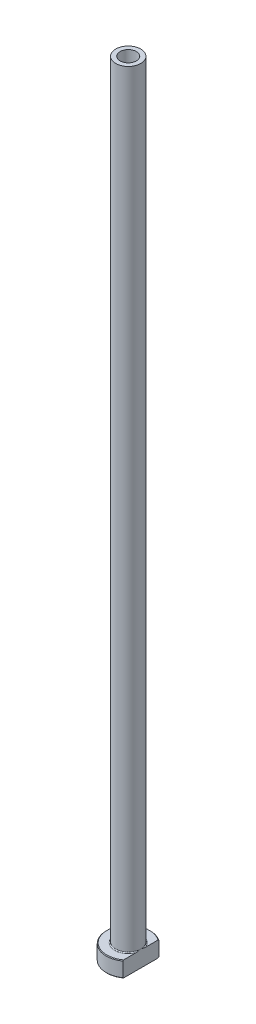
SolidWorks part; units mm, degrees
ref_plane "Front Plane" through (0, 0, 0) normal (0, 0, 1) x (1, 0, 0)
ref_plane "Top Plane" through (0, 0, 0) normal (0, 1, 0) x (1, 0, 0)
ref_plane "Right Plane" through (0, 0, 0) normal (1, 0, 0) x (0, 0, -1)
sketch "Sketch1" plane through (0, 0, 0) normal (0, 0, 1) x (1, 0, 0)
  line L0 (-2.6, 250) -> (-4, 250)
  line L1 (-4, 250) -> (-4, 5)
  line L2 (-4, 5) -> (-7, 5)
  line L3 (-7, 5) -> (-7, 0)
  line L4 (6.05, 0) -> (-6.05, 0) construction
  line L5 (-7, 0) -> (-2.85, 0)
  line L6 (-2.6, 205) -> (-2.6, 250)
  line L7 (0, 92.1877) -> (0, -15.5353) construction
  line L8 (0, -7.7) -> (0, 7.7) construction
  line L9 (-2.6, 205) -> (-2.85, 193)
  line L10 (-2.85, 193) -> (-2.85, 0)
  dimension "D1" = 0.25
  dimension "ID" = 5.2
  dimension "OD" = 8
  dimension "L" = 250
  dimension "H" = 14
  dimension "T" = 5
  dimension "N" = 45
  dimension "D2" = 12
  dimension "L-N" = 205
revolve "Revolve1" add sketch "Sketch1" angle 360 about L7
fillet "Fillet1" radius 0.3 1 edges at (0, 5, 4)
chamfer "Chamfer1" distance 0.2 angle 45 2 edges at (0, 5, 7) (0, 0, 7)
sketch "Sketch2" plane through (0, 0, 0) normal (0, -1, 0) x (1, 0, 0)
  line L0 (4, 5.7446) -> (4, -5.7446)
  circle A0 centre (0, 0) radius 7 construction
  arc A1 (4, 5.7446) -> (4, -5.7446) centre (0, 0) cw
  circle A2 centre (0, 0) radius 4 construction
extrude "Cut-Extrude1" cut sketch "Sketch2" against normal through all
chamfer "Chamfer2" distance 0.5 angle 45 1 edges at (0, 0, 2.85)
